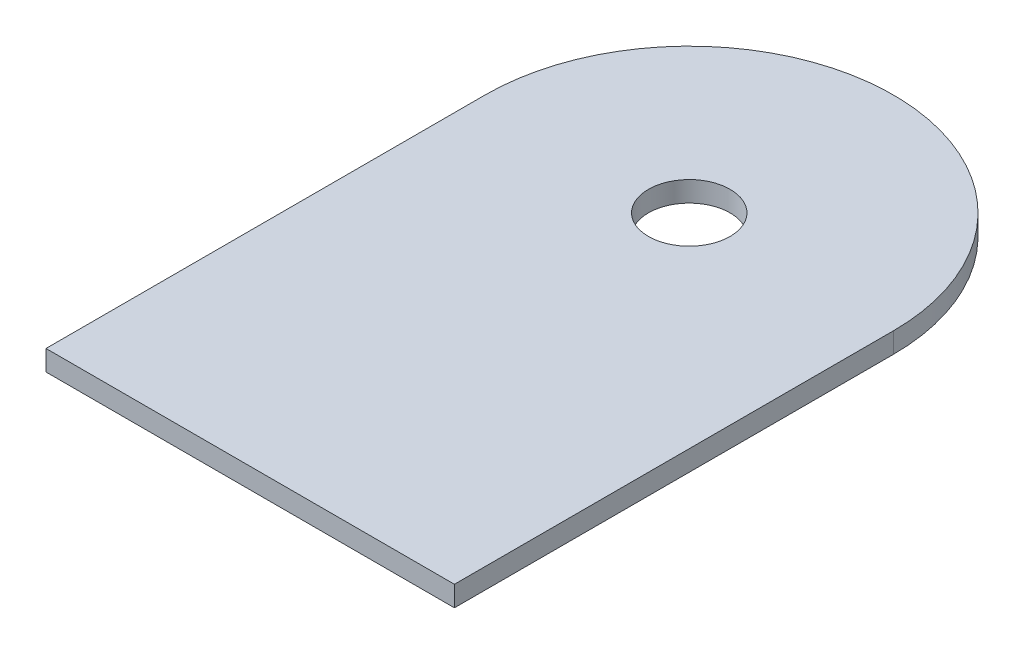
SolidWorks part; units mm, degrees
ref_plane "Front Plane" through (0, 0, 0) normal (0, 0, 1) x (1, 0, 0)
ref_plane "Top Plane" through (0, 0, 0) normal (0, 1, 0) x (1, 0, 0)
ref_plane "Right Plane" through (0, 0, 0) normal (1, 0, 0) x (0, 0, -1)
sketch "Sketch2" plane through (0, 0, 0) normal (0, 1, 0) x (1, 0, 0)
  line L0 (-43.75, 0) -> (43.75, 0) construction
  line L1 (20, 0) -> (20, -43)
  line L2 (20, -43) -> (-20, -43)
  line L4 (-20, 0) -> (-20, -43)
  circle A0 centre (0, 0) radius 4
  arc A1 (20, 0) -> (-20, 0) centre (0, 0) ccw
  point P7 (0, 0)
  dimension "D1" = 8
  dimension "D2" = 20
  dimension "D3" = 43
extrude "Boss-Extrude1" add sketch "Sketch2" along normal blind 2
